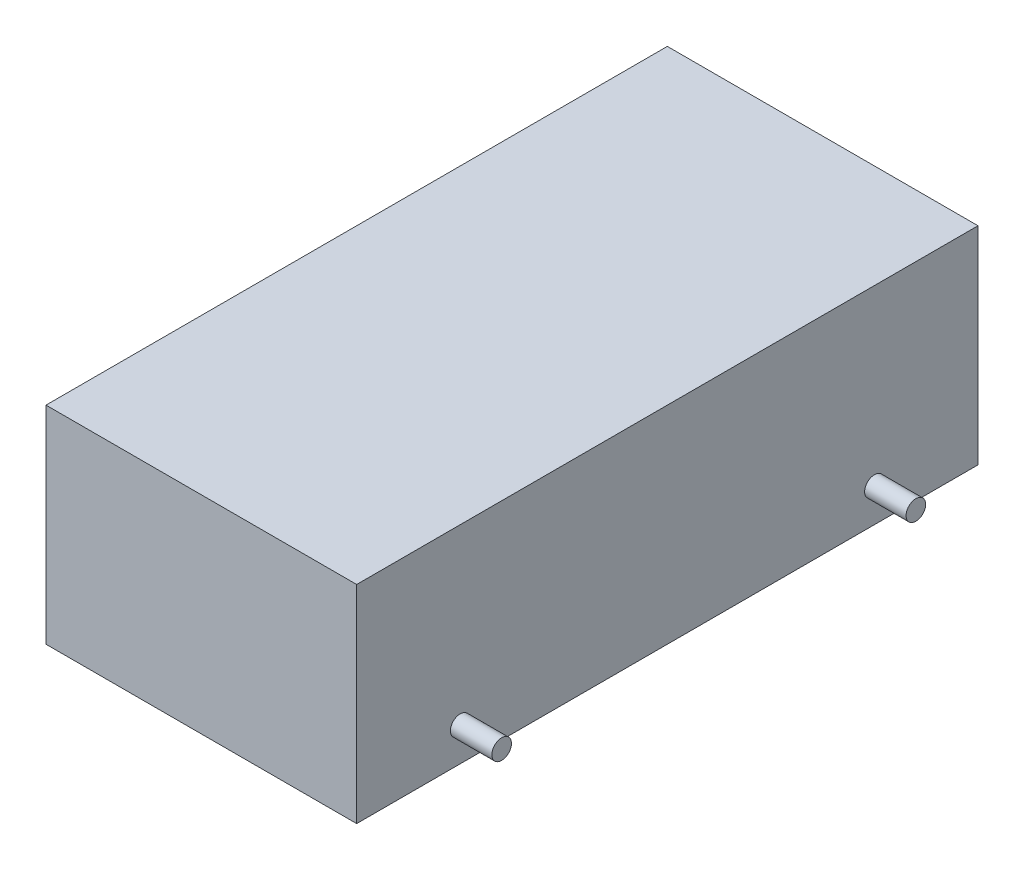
SolidWorks part; units mm, degrees
ref_plane "Front Plane" through (0, 0, 0) normal (0, 0, 1) x (1, 0, 0)
ref_plane "Top Plane" through (0, 0, 0) normal (0, 1, 0) x (1, 0, 0)
ref_plane "Right Plane" through (0, 0, 0) normal (1, 0, 0) x (0, 0, -1)
sketch "Sketch1" plane through (0, 0, 0) normal (0, 0, 1) x (1, 0, 0)
  line L0 (-37.5, 25) -> (37.5, -25) construction
  line L1 (-37.5, 25) -> (37.5, 25)
  line L2 (-37.5, 25) -> (-37.5, -25)
  line L3 (-37.5, -25) -> (37.5, -25)
  line L4 (37.5, 25) -> (37.5, -25)
  dimension "D1" = 75
  dimension "D2" = 50
extrude "Boss-Extrude1" add sketch "Sketch1" along normal blind 150
sketch "Sketch2" plane through (37.5, 0, 0) normal (1, 0, 0) x (0, 0, -1)
  line L0 (-125, -16.9192) -> (-25, -16.9192) construction
  line L1 (-150, -25) -> (-150, 25) construction
  line L2 (0, -25) -> (0, 25) construction
  circle A0 centre (-125, -16.9192) radius 2.3696
  circle A1 centre (-25, -16.9192) radius 2.3696
  point P9 (0, 0)
  dimension "D1" = 25
  dimension "D2" = 25
extrude "Boss-Extrude2" add sketch "Sketch2" along normal blind 10
sketch "Sketch3" plane through (-37.5, 0, 0) normal (-1, 0, 0) x (0, 0, 1)
  circle A1 centre (25, -16.9192) radius 2.3696
  circle A2 centre (25, -16.9192) radius 2.3696
  circle A3 centre (125, -16.9192) radius 2.3696
  circle A4 centre (125, -16.9192) radius 2.3696
  dimension "D1" = 0
  dimension "D2" = 0
extrude "Boss-Extrude3" add sketch "Sketch3" along normal blind 10
